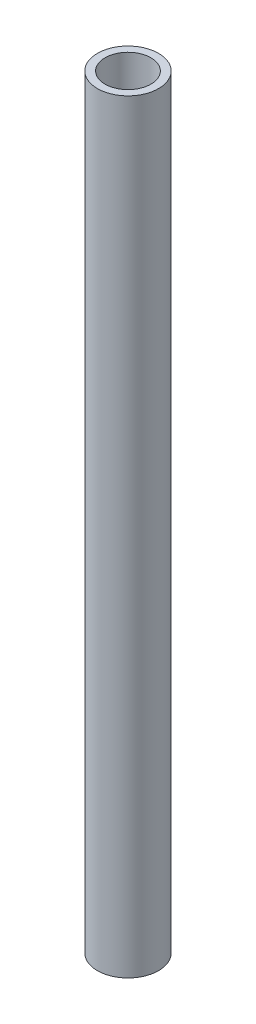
SolidWorks part; units mm, degrees
ref_plane "前视基准面" through (0, 0, 0) normal (0, 0, 1) x (1, 0, 0)
ref_plane "上视基准面" through (0, 0, 0) normal (0, 1, 0) x (1, 0, 0)
ref_plane "右视基准面" through (0, 0, 0) normal (1, 0, 0) x (0, 0, -1)
other "Configuration Table"
sketch "草图1" plane through (0, 0, 0) normal (0, 1, 0) x (1, 0, 0)
  circle A0 centre (0, 0) radius 4
  circle A1 centre (0, 0) radius 3
  dimension "D1" = 8
  dimension "D2" = 6
extrude "凸台-拉伸1" add sketch "草图1" along normal blind 100
